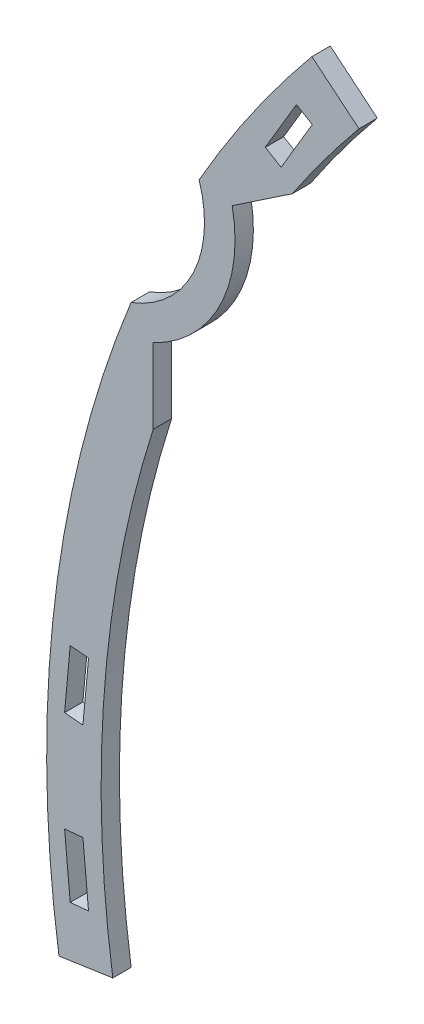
SolidWorks part; units mm, degrees
ref_plane "Ebene vorne" through (0, 0, 0) normal (0, 0, 1) x (1, 0, 0)
ref_plane "Ebene oben" through (0, 0, 0) normal (0, 1, 0) x (1, 0, 0)
ref_plane "Ebene rechts" through (0, 0, 0) normal (1, 0, 0) x (0, 0, -1)
sketch "Skizze1" plane through (0, 0, 0) normal (0, 0, 1) x (1, 0, 0)
  line L0 (-190.6957, -7.1544) -> (-188.5969, 10.4201) construction
  line L1 (-166.6207, 92.7484) -> (-194.4185, 96.1071) construction
  line L2 (-187.2839, -33.4342) -> (-178.4719, -32.1377)
  line L3 (-171.8633, 48.9347) -> (-171.8633, 61.2061)
  line L4 (-145.893, 114.742) -> (-138.1861, 108.37)
  line L5 (-195.0955, 9.5884) -> (-194.6367, 14.5673) construction
  line L6 (-195.0955, 9.5884) -> (-194.6367, 14.5673) construction
  line L7 (-185.4486, 11.4871) -> (-186.3663, 1.5293)
  line L8 (-158.939, 87.092) -> (-149.1116, 93.69)
  line L10 (-185.4486, 11.4871) -> (-182.4486, 11.2106)
  line L11 (-186.3663, 1.5293) -> (-183.3663, 1.2528)
  line L12 (-182.4486, 11.2106) -> (-183.3663, 1.2528)
  line L13 (-186.3663, -14.9502) -> (-185.4486, -24.908)
  line L14 (-186.3663, -14.9502) -> (-183.3663, -14.6737)
  line L15 (-185.4486, -24.908) -> (-182.4486, -24.6315)
  line L16 (-183.3663, -14.6737) -> (-182.4486, -24.6315)
  line L17 (-194.6367, -26.3278) -> (-195.0955, -21.3489) construction
  line L18 (-153.5188, 98.0691) -> (-148.425, 106.6745)
  line L19 (-153.5188, 98.0691) -> (-150.9263, 96.5345)
  line L20 (-148.425, 106.6745) -> (-145.8324, 105.1399)
  line L21 (-150.9263, 96.5345) -> (-145.8324, 105.1399)
  line L22 (-179.6726, 10.9972) -> (-201.5408, 13.436) construction
  arc A0 (-105.3868, 153.0541) -> (0, -196.5802) centre (0, -5.8802) ccw construction
  circle A1 centre (-181.9702, 82.4217) radius 18.5
  arc A2 (-104.6132, 151.8873) -> (0, -195.1802) centre (0, -5.8802) ccw construction
  arc A3 (-145.893, 114.742) -> (-164.3489, 88.0555) centre (0, -5.8802) ccw
  arc A4 (-138.1861, 108.37) -> (-149.1116, 93.69) centre (0, -5.8802) ccw
  arc A5 (-104.6132, 151.8873) -> (0, -195.1802) centre (0, -5.8802) ccw construction
  arc A6 (-99.0868, 143.553) -> (0, -185.1802) centre (0, -5.8802) ccw construction
  arc A7 (-171.8633, 61.2061) -> (-158.939, 87.092) centre (-181.9702, 82.4217) ccw
  circle A8 centre (-181.9702, 82.4217) radius 23.5 construction
  circle A9 centre (-181.9702, 82.4217) radius 18.5 construction
  arc A10 (-175.4915, 65.0932) -> (-187.2839, -33.4342) centre (0, -5.8802) ccw
  arc A12 (-171.8633, 48.9347) -> (-178.4719, -32.1377) centre (0, -5.8802) ccw
  point P8 (-177.4452, 63.9745)
  point P31 (-180.5196, 94.4277)
  dimension "D2" = 37
  dimension "D1" = 90
  dimension "D3" = 28
  dimension "D7" = 3
  dimension "D8" = 10
  dimension "D4" = 10
  dimension "D5" = 5
extrude "Aufsatz-Linear austragen1" add sketch "Skizze1" along normal blind 3
